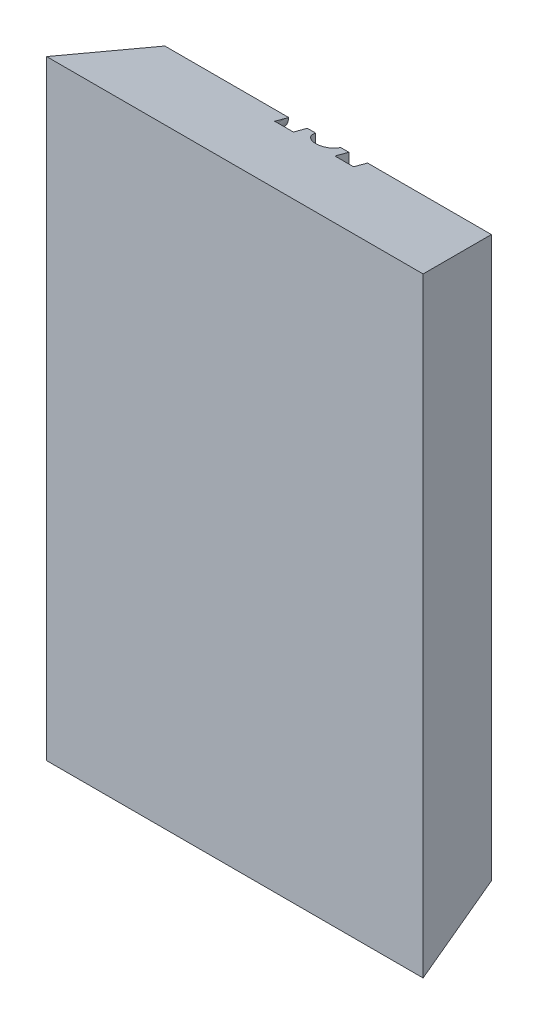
SolidWorks part; units mm, degrees
ref_plane "Front Plane" through (0, 0, 0) normal (0, 0, 1) x (1, 0, 0)
ref_plane "Top Plane" through (0, 0, 0) normal (0, 1, 0) x (1, 0, 0)
ref_plane "Right Plane" through (0, 0, 0) normal (1, 0, 0) x (0, 0, -1)
sketch "Sketch2" plane through (0, 0, 0) normal (0, 0, 1) x (1, 0, 0)
  line L1 (17.5, 55) -> (-17.5, 55)
  line L2 (17.5, 55) -> (17.5, -5)
  line L3 (17.5, -5) -> (-17.5, -5)
  line L4 (-17.5, 55) -> (-17.5, -5)
extrude "Boss-Extrude1" add sketch "Sketch2" along normal blind 10 draft 15
other "Cavity1"
other "Plucker_small_positive<2>@small_negative_mold1"
other "small_mold_a<1>@small_negative_mold1"
equation "\"D3@Sketch2\"=\"D1@Sketch2\"/2"
